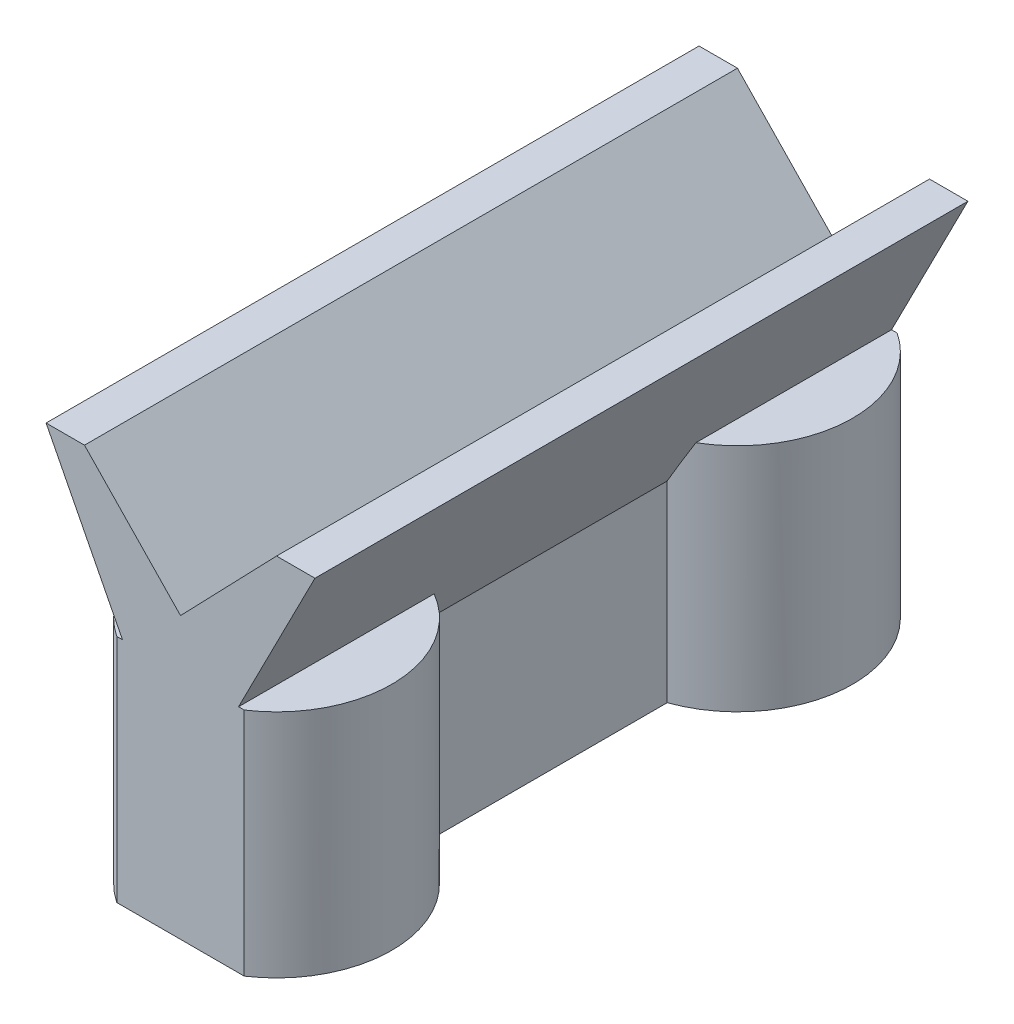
SolidWorks part; units mm, degrees
ref_plane "Plan de face" through (0, 0, 0) normal (0, 0, 1) x (1, 0, 0)
ref_plane "Plan de dessus" through (0, 0, 0) normal (0, 1, 0) x (1, 0, 0)
ref_plane "Plan de droite" through (0, 0, 0) normal (1, 0, 0) x (0, 0, -1)
sketch "Esquisse1" plane through (0, 0, 0) normal (0, 0, 1) x (1, 0, 0)
  line L0 (0, 0) -> (0, -4.5958) construction
  line L1 (0, -8.1433) -> (-1, -8.1433)
  line L2 (-1, -8.1433) -> (-1, -3.1433)
  line L3 (-1, -3.1433) -> (-3.5, 1.7498)
  line L4 (-3.5, 1.7498) -> (-2.5, 1.7498)
  line L5 (-2.5, 1.7498) -> (0, -0.8433)
  line L6 (0, -0.8433) -> (0, -8.1433)
  point P5 (-3, 1.7498)
  dimension "D1" = 1
  dimension "D2" = 7.3
  dimension "D3" = 9.893
  dimension "D4" = 5
  dimension "D5" = 3.5
  dimension "D6" = 1
extrude "Boss.-Extru.1" add sketch "Esquisse1" along normal blind 17
mirror "Symétrie1" about plane through (0, -0.8433, 17) normal (-1, 0, 0) of "Boss.-Extru.1"
sketch "Esquisse2" plane through (0, -8.1433, 0) normal (0, -1, 0) x (-1, 0, 0)
  line L0 (0, -17) -> (0, 0) construction
  line L1 (1, -17) -> (-1, -17) construction
  line L2 (1, 0) -> (-1, 0) construction
  circle A0 centre (0, -14.5) radius 3
  circle A1 centre (0, -2.5) radius 3
  dimension "D1" = 6
  dimension "D3" = 2.5
  dimension "D4" = 6
  dimension "D2" = 2.5
extrude "Boss.-Extru.2" add sketch "Esquisse2" against normal blind 6
sketch "Esquisse4" plane through (0, -2.1433, 0) normal (0, 1, 0) x (1, 0, 0)
  line L1 (-3.5, -17) -> (3.5461, -17)
  line L2 (-3.5, -17) -> (-3.5, -18.6917)
  line L3 (-3.5, -18.6917) -> (3.5461, -18.6917)
  line L4 (3.5461, -17) -> (3.5461, -18.6917)
  line L5 (-3.5, 0) -> (3.5461, 0)
  line L6 (-3.5, 0) -> (-3.5, 1.0495)
  line L7 (-3.5, 1.0495) -> (3.5461, 1.0495)
  line L8 (3.5461, 0) -> (3.5461, 1.0495)
extrude "Enlèv. mat.-Extru.1" cut sketch "Esquisse4" against normal through all
sketch "Esquisse5" plane through (0, -8.1433, 0) normal (0, -1, 0) x (1, 0, 0)
  circle A0 centre (0, 14.5) radius 1.3
  circle A1 centre (0, 2.5) radius 1.3
  dimension "D1" = 2.6
  dimension "D2" = 2.6
extrude "Enlèv. mat.-Extru.2" cut sketch "Esquisse5" against normal blind 6
